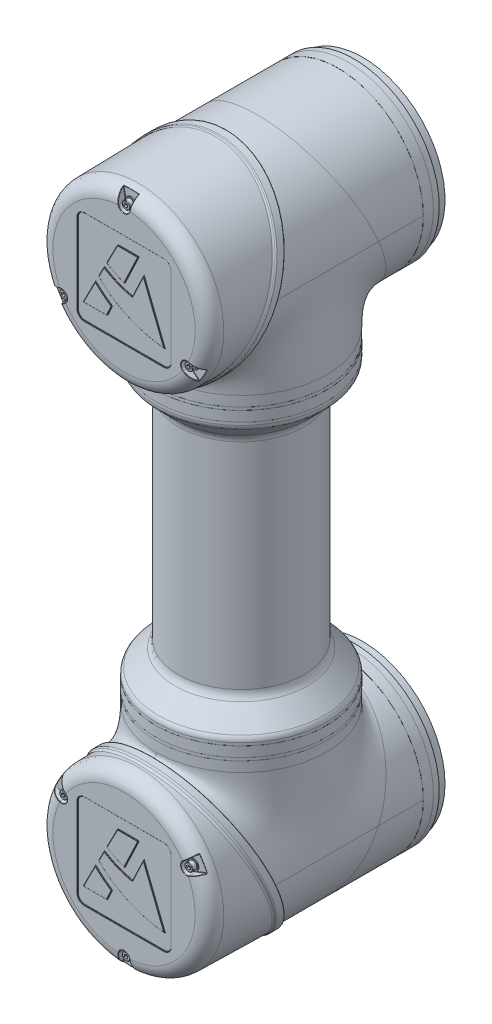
SolidWorks part; units mm, degrees
ref_plane "前视基准面" through (0, 0, 0) normal (0, 0, 1) x (1, 0, 0)
ref_plane "上视基准面" through (0, 0, 0) normal (0, 1, 0) x (1, 0, 0)
ref_plane "右视基准面" through (0, 0, 0) normal (1, 0, 0) x (0, 0, -1)
imported_body "SIZE3简化模型(反LOGO)-1-solid1"
imported_body "SIZE3简化模型(反LOGO)-1-solid2"
imported_body "SIZE3简化模型(反LOGO)-1-solid3"
imported_body "SIZE3简化模型(反LOGO)-1-solid4"
imported_body "GBT-C5A-200.01-0200_defeature-1-solid1"
imported_body "SIZE3简化模型-1-solid1"
imported_body "SIZE3简化模型-1-solid2"
imported_body "SIZE3简化模型-1-solid3"
imported_body "SIZE3简化模型-1-solid4"
sketch "草图1" plane through (0, 0, 0) normal (0, 0, 1) x (1, 0, 0)
  line L0 (0, 0) -> (0, 523.8448) construction
  line L1 (-57, 78) -> (57, 78) construction
  line L2 (57, 78) -> (59, 78)
  line L3 (57, 78) -> (57, 71)
  line L4 (57, 71) -> (59, 71)
  line L5 (59, 78) -> (59, 71)
  line L6 (-59, 78) -> (59, 78) construction
  line L7 (59, 71) -> (-59, 71) construction
  line L8 (-57, 354) -> (57, 354) construction
  line L9 (57, 354) -> (59, 354)
  line L10 (57, 354) -> (57, 347)
  line L11 (57, 347) -> (59, 347)
  line L12 (59, 354) -> (59, 347)
  line L13 (-59, 354) -> (59, 354) construction
  line L14 (59, 347) -> (-59, 347) construction
  line L15 (57, 347) -> (-57, 347) construction
  dimension "D1" = 114
  dimension "D2" = 2
  dimension "D3" = 114
  dimension "D4" = 2
revolve "旋转1" add sketch "草图1" angle 360 about L0
ref_plane "基准面1" through (0, 100.8137, 0) normal (0, 1, 0) x (1, 0, 0)
ref_plane "基准面2" through (0, 175.8137, 0) normal (0, 1, 0) x (1, 0, 0)
split "分割1" trim tools "基准面2", "基准面1" bodies to split 110 resulting bodies 117 118
move or copy body "实体-移动/复制1" bodies to move or copy 111 117 112 114 113 116 placed by mates yes
combine bodies "组合1" operation type add bodies to combine 118 120
